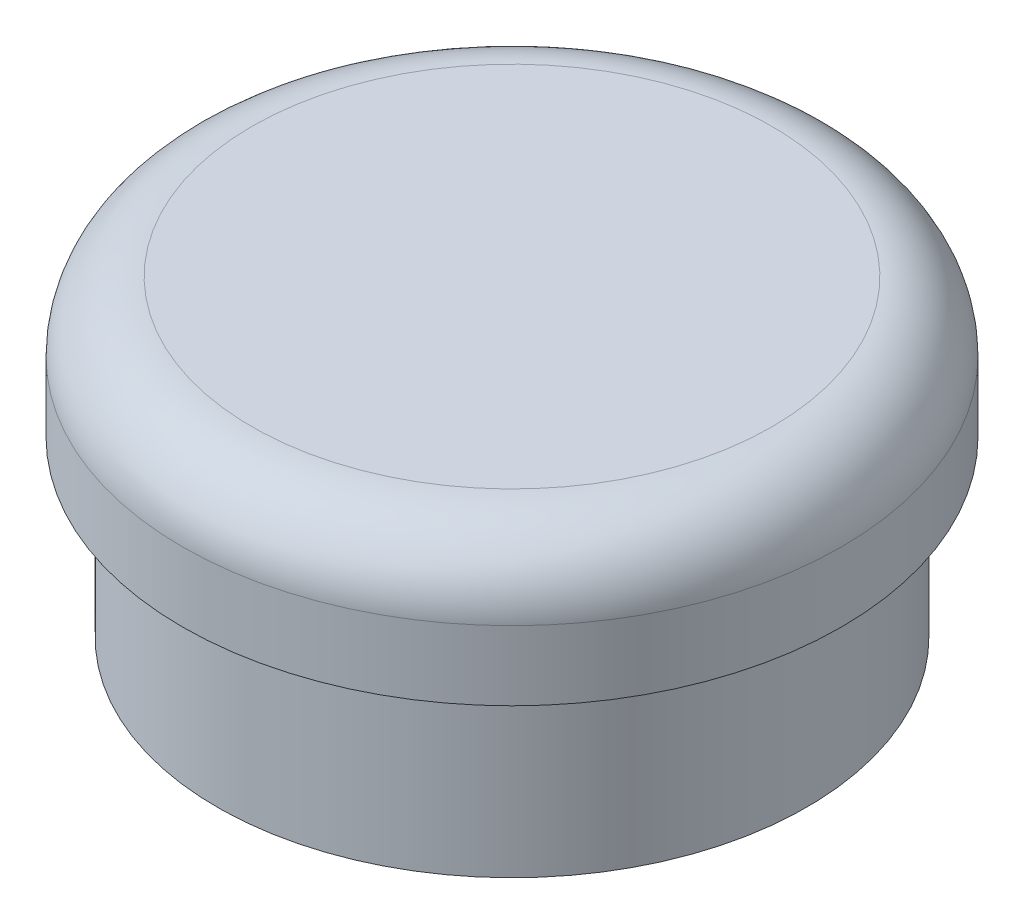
SolidWorks part; units mm, degrees
ref_plane "Plan de face" through (0, 0, 0) normal (0, 0, 1) x (1, 0, 0)
ref_plane "Plan de dessus" through (0, 0, 0) normal (0, 1, 0) x (1, 0, 0)
ref_plane "Plan de droite" through (0, 0, 0) normal (1, 0, 0) x (0, 0, -1)
ref_plane "Plan1" through (0, 0, 0) normal (0, 0, -1) x (-1, 0, 0)
sketch "Esquisse1" plane through (0, 0, 0) normal (0, 0, -1) x (-1, 0, 0)
  line L0 (-6.5, 7) -> (0, 7)
  line L1 (0, 7) -> (0, 9)
  line L2 (0, 9) -> (-7.5, 9)
  line L3 (-9.5, 7) -> (-9.5, 5)
  line L4 (-9.5, 5) -> (-8.5, 5)
  line L5 (-8.5, 5) -> (-8.5, 0)
  line L6 (-8.5, 0) -> (-6.5, 0)
  line L7 (-6.5, 0) -> (-6.5, 7)
  line L8 (0, 0) -> (0, 9.0013) construction
  arc A0 (-7.5, 9) -> (-9.5, 7) centre (-7.5, 7) ccw
revolve "Révolution1" add sketch "Esquisse1" angle 360 about L8
